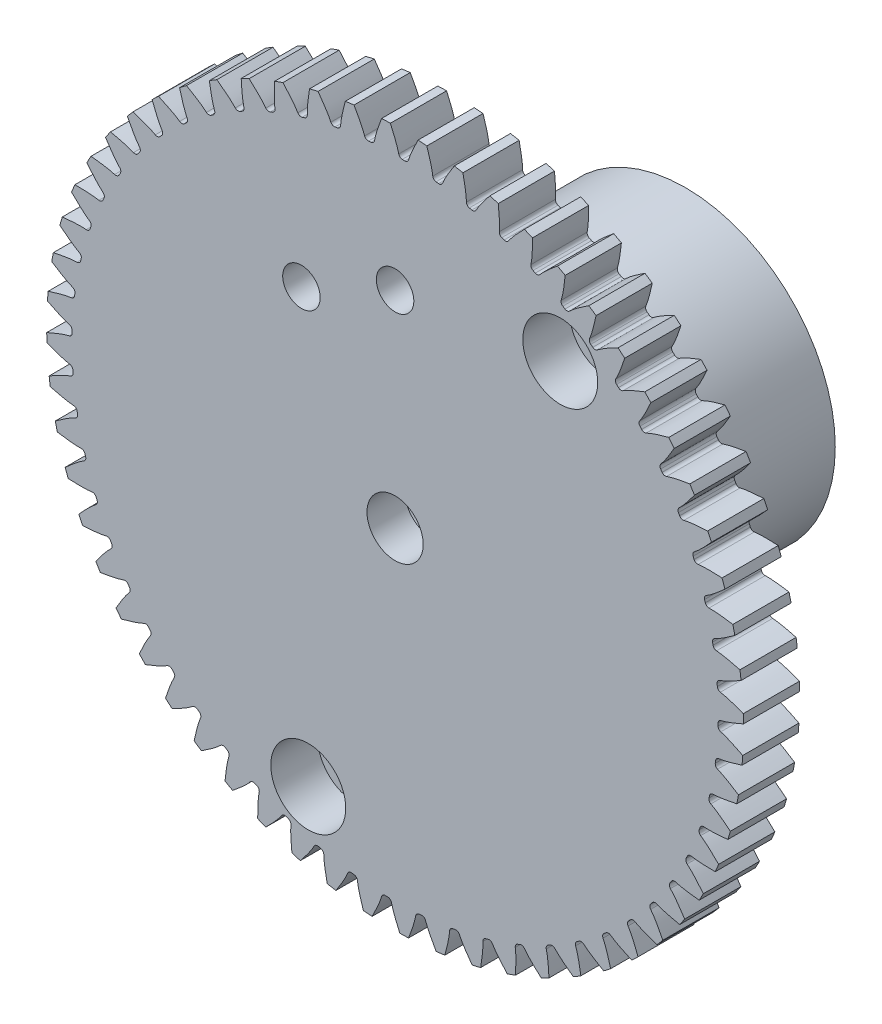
SolidWorks part; units mm, degrees
ref_plane "Face" through (0, 0, 0) normal (0, 0, 1) x (1, 0, 0)
ref_plane "Dessus" through (0, 0, 0) normal (0, 1, 0) x (1, 0, 0)
ref_plane "Droite" through (0, 0, 0) normal (1, 0, 0) x (0, 0, -1)
sketch "Esquisse1" plane through (0, 0, 0) normal (0, 0, 1) x (1, 0, 0)
  arc A480 (17.0932, -2.3205) -> (17.2163, -2.5327) centre (17.2913, -2.3474) ccw
  arc A481 (17.0932, -2.3205) -> (17.111, -2.1854) centre (0, 0) ccw
  arc A482 (17.2849, -2.0123) -> (17.111, -2.1854) centre (17.3093, -2.2107) ccw
  arc A483 (18.5227, -1.6943) -> (18.5595, -1.2271) centre (0, 0) ccw
  arc A484 (17.2421, -0.5211) -> (17.3867, -0.7192) centre (17.4419, -0.5271) ccw
  arc A485 (17.2421, -0.5211) -> (17.2457, -0.3848) centre (0, 0) ccw
  arc A486 (17.4005, -0.1945) -> (17.2457, -0.3848) centre (17.4456, -0.3893) ccw
  arc A487 (18.5983, 0.2511) -> (18.5861, 0.7196) centre (0, 0) ccw
  arc A488 (17.2021, 1.2841) -> (17.3667, 1.1021) centre (17.4015, 1.299) ccw
  arc A489 (17.2021, 1.2841) -> (17.1915, 1.42) centre (0, 0) ccw
  arc A490 (17.3255, 1.6254) -> (17.1915, 1.42) centre (17.3907, 1.4364) ccw
  arc A491 (18.4702, 2.1938) -> (18.409, 2.6585) centre (0, 0) ccw
  arc A492 (16.9737, 3.0752) -> (17.1563, 2.9114) centre (17.1704, 3.1108) ccw
  arc A493 (16.9737, 3.0752) -> (16.9489, 3.2092) centre (0, 0) ccw
  arc A494 (17.0607, 3.4275) -> (16.9489, 3.2092) centre (17.1453, 3.2464) ccw
  arc A495 (18.1397, 4.1124) -> (18.0303, 4.5682) centre (0, 0) ccw
  arc A496 (16.5593, 4.8326) -> (16.758, 4.6888) centre (16.7512, 4.8886) ccw
  arc A497 (16.5593, 4.8326) -> (16.5205, 4.9633) centre (0, 0) ccw
  arc A498 (16.609, 5.1921) -> (16.5205, 4.9633) centre (16.712, 5.0208) ccw
  arc A499 (17.6104, 5.986) -> (17.454, 6.4278) centre (0, 0) ccw
  arc A500 (15.9634, 6.537) -> (16.1761, 6.4148) centre (16.1484, 6.6127) ccw
  arc A501 (15.9634, 6.537) -> (15.9112, 6.6629) centre (0, 0) ccw
  arc A502 (15.9753, 6.8997) -> (15.9112, 6.6629) centre (16.0956, 6.7401) ccw
  arc A503 (16.8883, 7.794) -> (16.6865, 8.2171) centre (0, 0) ccw
  arc A504 (15.1927, 8.1698) -> (15.417, 8.0705) centre (15.3687, 8.2645) ccw
  arc A505 (15.1927, 8.1698) -> (15.1276, 8.2896) centre (0, 0) ccw
  arc A506 (15.1665, 8.5318) -> (15.1276, 8.2896) centre (15.3029, 8.3857) ccw
  arc A507 (15.9811, 9.5166) -> (15.7362, 9.9163) centre (0, 0) ccw
  arc A508 (14.2554, 9.7131) -> (14.4889, 9.6378) centre (14.4206, 9.8257) ccw
  arc A509 (14.2554, 9.7131) -> (14.1782, 9.8255) centre (0, 0) ccw
  arc A510 (14.1916, 10.0704) -> (14.1782, 9.8255) centre (14.3425, 9.9393) ccw
  arc A511 (14.8988, 11.1349) -> (14.6135, 11.5068) centre (0, 0) ccw
  arc A512 (13.1621, 11.15) -> (13.4021, 11.0995) centre (13.3146, 11.2792) ccw
  arc A513 (13.1621, 11.15) -> (13.0735, 11.2537) centre (0, 0) ccw
  arc A514 (13.0612, 11.4987) -> (13.0735, 11.2537) centre (13.225, 11.3841) ccw
  arc A515 (13.6532, 12.6313) -> (13.3306, 12.9713) centre (0, 0) ccw
  arc A516 (11.9245, 12.4647) -> (12.1685, 12.4396) centre (12.0626, 12.6092) ccw
  arc A517 (11.9245, 12.4647) -> (11.8256, 12.5586) centre (0, 0) ccw
  arc A518 (11.7877, 12.801) -> (11.8256, 12.5586) centre (11.9626, 12.7041) ccw
  arc A519 (12.2581, 13.9892) -> (11.9017, 14.2937) centre (0, 0) ccw
  arc A520 (10.5562, 13.6429) -> (10.8015, 13.6434) centre (10.6785, 13.801) ccw
  arc A521 (10.5562, 13.6429) -> (10.4481, 13.7259) centre (0, 0) ccw
  arc A522 (10.3851, 13.963) -> (10.4481, 13.7259) centre (10.5692, 13.885) ccw
  arc A523 (10.7287, 15.1939) -> (10.3424, 15.4594) centre (0, 0) ccw
  arc A524 (9.0723, 14.6716) -> (9.3162, 14.6977) centre (9.1775, 14.8416) ccw
  arc A525 (9.0723, 14.6716) -> (8.9561, 14.7428) centre (0, 0) ccw
  arc A526 (8.8687, 14.972) -> (8.9561, 14.7428) centre (9.0599, 14.9137) ccw
  arc A527 (9.0817, 16.2322) -> (8.6698, 16.4558) centre (0, 0) ccw
  arc A528 (7.489, 15.5395) -> (7.7289, 15.591) centre (7.5758, 15.7196) ccw
  arc A529 (7.489, 15.5395) -> (7.366, 15.5982) centre (0, 0) ccw
  arc A530 (7.2551, 15.817) -> (7.366, 15.5982) centre (7.4513, 15.779) ccw
  arc A531 (7.3352, 17.0925) -> (6.9022, 17.2719) centre (0, 0) ccw
  arc A532 (5.8237, 16.2372) -> (6.0568, 16.3135) centre (5.8912, 16.4254) ccw
  arc A533 (5.8237, 16.2372) -> (5.6952, 16.2827) centre (0, 0) ccw
  arc A534 (5.562, 16.4888) -> (5.6952, 16.2827) centre (5.7612, 16.4714) ccw
  arc A535 (5.5084, 17.7656) -> (5.059, 17.8988) centre (0, 0) ccw
  arc A536 (4.0945, 16.757) -> (4.3184, 16.8572) centre (4.142, 16.9512) ccw
  arc A537 (4.0945, 16.757) -> (3.962, 16.7888) centre (0, 0) ccw
  arc A538 (3.808, 16.9798) -> (3.962, 16.7888) centre (4.0079, 16.9834) ccw
  arc A539 (3.6212, 18.2441) -> (3.1603, 18.3295) centre (0, 0) ccw
  arc A540 (2.3205, 17.0932) -> (2.5327, 17.2163) centre (2.3474, 17.2913) ccw
  arc A541 (2.3205, 17.0932) -> (2.1854, 17.111) centre (0, 0) ccw
  arc A542 (2.0123, 17.2849) -> (2.1854, 17.111) centre (2.2107, 17.3093) ccw
  arc A543 (1.6943, 18.5227) -> (1.2271, 18.5595) centre (0, 0) ccw
  arc A544 (0.5211, 17.2421) -> (0.7192, 17.3867) centre (0.5271, 17.4419) ccw
  arc A545 (0.5211, 17.2421) -> (0.3848, 17.2457) centre (0, 0) ccw
  arc A546 (0.1945, 17.4005) -> (0.3848, 17.2457) centre (0.3893, 17.4456) ccw
  arc A547 (-0.2511, 18.5983) -> (-0.7196, 18.5861) centre (0, 0) ccw
  arc A548 (-1.2841, 17.2021) -> (-1.1021, 17.3667) centre (-1.299, 17.4015) ccw
  arc A549 (-1.2841, 17.2021) -> (-1.42, 17.1915) centre (0, 0) ccw
  arc A550 (-1.6254, 17.3255) -> (-1.42, 17.1915) centre (-1.4364, 17.3907) ccw
  arc A551 (-2.1938, 18.4702) -> (-2.6585, 18.409) centre (0, 0) ccw
  arc A552 (-3.0752, 16.9737) -> (-2.9114, 17.1563) centre (-3.1108, 17.1704) ccw
  arc A553 (-3.0752, 16.9737) -> (-3.2092, 16.9489) centre (0, 0) ccw
  arc A554 (-3.4275, 17.0607) -> (-3.2092, 16.9489) centre (-3.2464, 17.1453) ccw
  arc A555 (-4.1124, 18.1397) -> (-4.5682, 18.0303) centre (0, 0) ccw
  arc A556 (-4.8326, 16.5593) -> (-4.6888, 16.758) centre (-4.8886, 16.7512) ccw
  arc A557 (-4.8326, 16.5593) -> (-4.9633, 16.5205) centre (0, 0) ccw
  arc A558 (-5.1921, 16.609) -> (-4.9633, 16.5205) centre (-5.0208, 16.712) ccw
  arc A559 (-5.986, 17.6104) -> (-6.4278, 17.454) centre (0, 0) ccw
  arc A560 (-6.537, 15.9634) -> (-6.4148, 16.1761) centre (-6.6127, 16.1484) ccw
  arc A561 (-6.537, 15.9634) -> (-6.6629, 15.9112) centre (0, 0) ccw
  arc A562 (-6.8997, 15.9753) -> (-6.6629, 15.9112) centre (-6.7401, 16.0956) ccw
  arc A563 (-7.794, 16.8883) -> (-8.2171, 16.6865) centre (0, 0) ccw
  arc A564 (-8.1698, 15.1927) -> (-8.0705, 15.417) centre (-8.2645, 15.3687) ccw
  arc A565 (-8.1698, 15.1927) -> (-8.2896, 15.1276) centre (0, 0) ccw
  arc A566 (-8.5318, 15.1665) -> (-8.2896, 15.1276) centre (-8.3857, 15.3029) ccw
  arc A567 (-9.5166, 15.9811) -> (-9.9163, 15.7362) centre (0, 0) ccw
  arc A568 (-9.7131, 14.2554) -> (-9.6378, 14.4889) centre (-9.8257, 14.4206) ccw
  arc A569 (-9.7131, 14.2554) -> (-9.8255, 14.1782) centre (0, 0) ccw
  arc A570 (-10.0704, 14.1916) -> (-9.8255, 14.1782) centre (-9.9393, 14.3425) ccw
  arc A571 (-11.1349, 14.8988) -> (-11.5068, 14.6135) centre (0, 0) ccw
  arc A572 (-11.15, 13.1621) -> (-11.0995, 13.4021) centre (-11.2792, 13.3146) ccw
  arc A573 (-11.15, 13.1621) -> (-11.2537, 13.0735) centre (0, 0) ccw
  arc A574 (-11.4987, 13.0612) -> (-11.2537, 13.0735) centre (-11.3841, 13.225) ccw
  arc A575 (-12.6313, 13.6532) -> (-12.9713, 13.3306) centre (0, 0) ccw
  arc A576 (-12.4647, 11.9245) -> (-12.4396, 12.1685) centre (-12.6092, 12.0626) ccw
  arc A577 (-12.4647, 11.9245) -> (-12.5586, 11.8256) centre (0, 0) ccw
  arc A578 (-12.801, 11.7877) -> (-12.5586, 11.8256) centre (-12.7041, 11.9626) ccw
  arc A579 (-13.9892, 12.2581) -> (-14.2937, 11.9017) centre (0, 0) ccw
  arc A580 (-13.6429, 10.5562) -> (-13.6434, 10.8015) centre (-13.801, 10.6785) ccw
  arc A581 (-13.6429, 10.5562) -> (-13.7259, 10.4481) centre (0, 0) ccw
  arc A582 (-13.963, 10.3851) -> (-13.7259, 10.4481) centre (-13.885, 10.5692) ccw
  arc A583 (-15.1939, 10.7287) -> (-15.4594, 10.3424) centre (0, 0) ccw
  arc A584 (-14.6716, 9.0723) -> (-14.6977, 9.3162) centre (-14.8416, 9.1775) ccw
  arc A585 (-14.6716, 9.0723) -> (-14.7428, 8.9561) centre (0, 0) ccw
  arc A586 (-14.972, 8.8687) -> (-14.7428, 8.9561) centre (-14.9137, 9.0599) ccw
  arc A587 (-16.2322, 9.0817) -> (-16.4558, 8.6698) centre (0, 0) ccw
  arc A588 (-15.5395, 7.489) -> (-15.591, 7.7289) centre (-15.7196, 7.5758) ccw
  arc A589 (-15.5395, 7.489) -> (-15.5982, 7.366) centre (0, 0) ccw
  arc A590 (-15.817, 7.2551) -> (-15.5982, 7.366) centre (-15.779, 7.4513) ccw
  arc A591 (-17.0925, 7.3352) -> (-17.2719, 6.9022) centre (0, 0) ccw
  arc A592 (-16.2372, 5.8237) -> (-16.3135, 6.0568) centre (-16.4254, 5.8912) ccw
  arc A593 (-16.2372, 5.8237) -> (-16.2827, 5.6952) centre (0, 0) ccw
  arc A594 (-16.4888, 5.562) -> (-16.2827, 5.6952) centre (-16.4714, 5.7612) ccw
  arc A595 (-17.7656, 5.5084) -> (-17.8988, 5.059) centre (0, 0) ccw
  arc A596 (-16.757, 4.0945) -> (-16.8572, 4.3184) centre (-16.9512, 4.142) ccw
  arc A597 (-16.757, 4.0945) -> (-16.7888, 3.962) centre (0, 0) ccw
  arc A598 (-16.9798, 3.808) -> (-16.7888, 3.962) centre (-16.9834, 4.0079) ccw
  arc A599 (-18.2441, 3.6212) -> (-18.3295, 3.1603) centre (0, 0) ccw
  arc A600 (-17.0932, 2.3205) -> (-17.2163, 2.5327) centre (-17.2913, 2.3474) ccw
  arc A601 (-17.0932, 2.3205) -> (-17.111, 2.1854) centre (0, 0) ccw
  arc A602 (-17.2849, 2.0123) -> (-17.111, 2.1854) centre (-17.3093, 2.2107) ccw
  arc A603 (-18.5227, 1.6943) -> (-18.5595, 1.2271) centre (0, 0) ccw
  arc A604 (-17.2421, 0.5211) -> (-17.3867, 0.7192) centre (-17.4419, 0.5271) ccw
  arc A605 (-17.2421, 0.5211) -> (-17.2457, 0.3848) centre (0, 0) ccw
  arc A606 (-17.4005, 0.1945) -> (-17.2457, 0.3848) centre (-17.4456, 0.3893) ccw
  arc A607 (-18.5983, -0.2511) -> (-18.5861, -0.7196) centre (0, 0) ccw
  arc A608 (-17.2021, -1.2841) -> (-17.3667, -1.1021) centre (-17.4015, -1.299) ccw
  arc A609 (-17.2021, -1.2841) -> (-17.1915, -1.42) centre (0, 0) ccw
  arc A610 (-17.3255, -1.6254) -> (-17.1915, -1.42) centre (-17.3907, -1.4364) ccw
  arc A611 (-18.4702, -2.1938) -> (-18.409, -2.6585) centre (0, 0) ccw
  arc A612 (-16.9737, -3.0752) -> (-17.1563, -2.9114) centre (-17.1704, -3.1108) ccw
  arc A613 (-16.9737, -3.0752) -> (-16.9489, -3.2092) centre (0, 0) ccw
  arc A614 (-17.0607, -3.4275) -> (-16.9489, -3.2092) centre (-17.1453, -3.2464) ccw
  arc A615 (-18.1397, -4.1124) -> (-18.0303, -4.5682) centre (0, 0) ccw
  arc A616 (-16.5593, -4.8326) -> (-16.758, -4.6888) centre (-16.7512, -4.8886) ccw
  arc A617 (-16.5593, -4.8326) -> (-16.5205, -4.9633) centre (0, 0) ccw
  arc A618 (-16.609, -5.1921) -> (-16.5205, -4.9633) centre (-16.712, -5.0208) ccw
  arc A619 (-17.6104, -5.986) -> (-17.454, -6.4278) centre (0, 0) ccw
  arc A620 (-15.9634, -6.537) -> (-16.1761, -6.4148) centre (-16.1484, -6.6127) ccw
  arc A621 (-15.9634, -6.537) -> (-15.9112, -6.6629) centre (0, 0) ccw
  arc A622 (-15.9753, -6.8997) -> (-15.9112, -6.6629) centre (-16.0956, -6.7401) ccw
  arc A623 (-16.8883, -7.794) -> (-16.6865, -8.2171) centre (0, 0) ccw
  arc A624 (-15.1927, -8.1698) -> (-15.417, -8.0705) centre (-15.3687, -8.2645) ccw
  arc A625 (-15.1927, -8.1698) -> (-15.1276, -8.2896) centre (0, 0) ccw
  arc A626 (-15.1665, -8.5318) -> (-15.1276, -8.2896) centre (-15.3029, -8.3857) ccw
  arc A627 (-15.9811, -9.5166) -> (-15.7362, -9.9163) centre (0, 0) ccw
  arc A628 (-14.2554, -9.7131) -> (-14.4889, -9.6378) centre (-14.4206, -9.8257) ccw
  arc A629 (-14.2554, -9.7131) -> (-14.1782, -9.8255) centre (0, 0) ccw
  arc A630 (-14.1916, -10.0704) -> (-14.1782, -9.8255) centre (-14.3425, -9.9393) ccw
  arc A631 (-14.8988, -11.1349) -> (-14.6135, -11.5068) centre (0, 0) ccw
  arc A632 (-13.1621, -11.15) -> (-13.4021, -11.0995) centre (-13.3146, -11.2792) ccw
  arc A633 (-13.1621, -11.15) -> (-13.0735, -11.2537) centre (0, 0) ccw
  arc A634 (-13.0612, -11.4987) -> (-13.0735, -11.2537) centre (-13.225, -11.3841) ccw
  arc A635 (-13.6532, -12.6313) -> (-13.3306, -12.9713) centre (0, 0) ccw
  arc A636 (-11.9245, -12.4647) -> (-12.1685, -12.4396) centre (-12.0626, -12.6092) ccw
  arc A637 (-11.9245, -12.4647) -> (-11.8256, -12.5586) centre (0, 0) ccw
  arc A638 (-11.7877, -12.801) -> (-11.8256, -12.5586) centre (-11.9626, -12.7041) ccw
  arc A639 (-12.2581, -13.9892) -> (-11.9017, -14.2937) centre (0, 0) ccw
  arc A640 (-10.5562, -13.6429) -> (-10.8015, -13.6434) centre (-10.6785, -13.801) ccw
  arc A641 (-10.5562, -13.6429) -> (-10.4481, -13.7259) centre (0, 0) ccw
  arc A642 (-10.3851, -13.963) -> (-10.4481, -13.7259) centre (-10.5692, -13.885) ccw
  arc A643 (-10.7287, -15.1939) -> (-10.3424, -15.4594) centre (0, 0) ccw
  arc A644 (-9.0723, -14.6716) -> (-9.3162, -14.6977) centre (-9.1775, -14.8416) ccw
  arc A645 (-9.0723, -14.6716) -> (-8.9561, -14.7428) centre (0, 0) ccw
  arc A646 (-8.8687, -14.972) -> (-8.9561, -14.7428) centre (-9.0599, -14.9137) ccw
  arc A647 (-9.0817, -16.2322) -> (-8.6698, -16.4558) centre (0, 0) ccw
  arc A648 (-7.489, -15.5395) -> (-7.7289, -15.591) centre (-7.5758, -15.7196) ccw
  arc A649 (-7.489, -15.5395) -> (-7.366, -15.5982) centre (0, 0) ccw
  arc A650 (-7.2551, -15.817) -> (-7.366, -15.5982) centre (-7.4513, -15.779) ccw
  arc A651 (-7.3352, -17.0925) -> (-6.9022, -17.2719) centre (0, 0) ccw
  arc A652 (-5.8237, -16.2372) -> (-6.0568, -16.3135) centre (-5.8912, -16.4254) ccw
  arc A653 (-5.8237, -16.2372) -> (-5.6952, -16.2827) centre (0, 0) ccw
  arc A654 (-5.562, -16.4888) -> (-5.6952, -16.2827) centre (-5.7612, -16.4714) ccw
  arc A655 (-5.5084, -17.7656) -> (-5.059, -17.8988) centre (0, 0) ccw
  arc A656 (-4.0945, -16.757) -> (-4.3184, -16.8572) centre (-4.142, -16.9512) ccw
  arc A657 (-4.0945, -16.757) -> (-3.962, -16.7888) centre (0, 0) ccw
  arc A658 (-3.808, -16.9798) -> (-3.962, -16.7888) centre (-4.0079, -16.9834) ccw
  arc A659 (-3.6212, -18.2441) -> (-3.1603, -18.3295) centre (0, 0) ccw
  arc A660 (-2.3205, -17.0932) -> (-2.5327, -17.2163) centre (-2.3474, -17.2913) ccw
  arc A661 (-2.3205, -17.0932) -> (-2.1854, -17.111) centre (0, 0) ccw
  arc A662 (-2.0123, -17.2849) -> (-2.1854, -17.111) centre (-2.2107, -17.3093) ccw
  arc A663 (-1.6943, -18.5227) -> (-1.2271, -18.5595) centre (0, 0) ccw
  arc A664 (-0.5211, -17.2421) -> (-0.7192, -17.3867) centre (-0.5271, -17.4419) ccw
  arc A665 (-0.5211, -17.2421) -> (-0.3848, -17.2457) centre (0, 0) ccw
  arc A666 (-0.1945, -17.4005) -> (-0.3848, -17.2457) centre (-0.3893, -17.4456) ccw
  arc A667 (0.2511, -18.5983) -> (0.7196, -18.5861) centre (0, 0) ccw
  arc A668 (1.2841, -17.2021) -> (1.1021, -17.3667) centre (1.299, -17.4015) ccw
  arc A669 (1.2841, -17.2021) -> (1.42, -17.1915) centre (0, 0) ccw
  arc A670 (1.6254, -17.3255) -> (1.42, -17.1915) centre (1.4364, -17.3907) ccw
  arc A671 (2.1938, -18.4702) -> (2.6585, -18.409) centre (0, 0) ccw
  arc A672 (3.0752, -16.9737) -> (2.9114, -17.1563) centre (3.1108, -17.1704) ccw
  arc A673 (3.0752, -16.9737) -> (3.2092, -16.9489) centre (0, 0) ccw
  arc A674 (3.4275, -17.0607) -> (3.2092, -16.9489) centre (3.2464, -17.1453) ccw
  arc A675 (4.1124, -18.1397) -> (4.5682, -18.0303) centre (0, 0) ccw
  arc A676 (4.8326, -16.5593) -> (4.6888, -16.758) centre (4.8886, -16.7512) ccw
  arc A677 (4.8326, -16.5593) -> (4.9633, -16.5205) centre (0, 0) ccw
  arc A678 (5.1921, -16.609) -> (4.9633, -16.5205) centre (5.0208, -16.712) ccw
  arc A679 (5.986, -17.6104) -> (6.4278, -17.454) centre (0, 0) ccw
  arc A680 (6.537, -15.9634) -> (6.4148, -16.1761) centre (6.6127, -16.1484) ccw
  arc A681 (6.537, -15.9634) -> (6.6629, -15.9112) centre (0, 0) ccw
  arc A682 (6.8997, -15.9753) -> (6.6629, -15.9112) centre (6.7401, -16.0956) ccw
  arc A683 (7.794, -16.8883) -> (8.2171, -16.6865) centre (0, 0) ccw
  arc A684 (8.1698, -15.1927) -> (8.0705, -15.417) centre (8.2645, -15.3687) ccw
  arc A685 (8.1698, -15.1927) -> (8.2896, -15.1276) centre (0, 0) ccw
  arc A686 (8.5318, -15.1665) -> (8.2896, -15.1276) centre (8.3857, -15.3029) ccw
  arc A687 (9.5166, -15.9811) -> (9.9163, -15.7362) centre (0, 0) ccw
  arc A688 (9.7131, -14.2554) -> (9.6378, -14.4889) centre (9.8257, -14.4206) ccw
  arc A689 (9.7131, -14.2554) -> (9.8255, -14.1782) centre (0, 0) ccw
  arc A690 (10.0704, -14.1916) -> (9.8255, -14.1782) centre (9.9393, -14.3425) ccw
  arc A691 (11.1349, -14.8988) -> (11.5068, -14.6135) centre (0, 0) ccw
  arc A692 (11.15, -13.1621) -> (11.0995, -13.4021) centre (11.2792, -13.3146) ccw
  arc A693 (11.15, -13.1621) -> (11.2537, -13.0735) centre (0, 0) ccw
  arc A694 (11.4987, -13.0612) -> (11.2537, -13.0735) centre (11.3841, -13.225) ccw
  arc A695 (12.6313, -13.6532) -> (12.9713, -13.3306) centre (0, 0) ccw
  arc A696 (12.4647, -11.9245) -> (12.4396, -12.1685) centre (12.6092, -12.0626) ccw
  arc A697 (12.4647, -11.9245) -> (12.5586, -11.8256) centre (0, 0) ccw
  arc A698 (12.801, -11.7877) -> (12.5586, -11.8256) centre (12.7041, -11.9626) ccw
  arc A699 (13.9892, -12.2581) -> (14.2937, -11.9017) centre (0, 0) ccw
  arc A700 (13.6429, -10.5562) -> (13.6434, -10.8015) centre (13.801, -10.6785) ccw
  arc A701 (13.6429, -10.5562) -> (13.7259, -10.4481) centre (0, 0) ccw
  arc A702 (13.963, -10.3851) -> (13.7259, -10.4481) centre (13.885, -10.5692) ccw
  arc A703 (15.1939, -10.7287) -> (15.4594, -10.3424) centre (0, 0) ccw
  arc A704 (14.6716, -9.0723) -> (14.6977, -9.3162) centre (14.8416, -9.1775) ccw
  arc A705 (14.6716, -9.0723) -> (14.7428, -8.9561) centre (0, 0) ccw
  arc A706 (14.972, -8.8687) -> (14.7428, -8.9561) centre (14.9137, -9.0599) ccw
  arc A707 (16.2322, -9.0817) -> (16.4558, -8.6698) centre (0, 0) ccw
  arc A708 (15.5395, -7.489) -> (15.591, -7.7289) centre (15.7196, -7.5758) ccw
  arc A709 (15.5395, -7.489) -> (15.5982, -7.366) centre (0, 0) ccw
  arc A710 (15.817, -7.2551) -> (15.5982, -7.366) centre (15.779, -7.4513) ccw
  arc A711 (17.0925, -7.3352) -> (17.2719, -6.9022) centre (0, 0) ccw
  arc A712 (16.2372, -5.8237) -> (16.3135, -6.0568) centre (16.4254, -5.8912) ccw
  arc A713 (16.2372, -5.8237) -> (16.2827, -5.6952) centre (0, 0) ccw
  arc A714 (16.4888, -5.562) -> (16.2827, -5.6952) centre (16.4714, -5.7612) ccw
  arc A715 (17.7656, -5.5084) -> (17.8988, -5.059) centre (0, 0) ccw
  arc A716 (16.757, -4.0945) -> (16.8572, -4.3184) centre (16.9512, -4.142) ccw
  arc A717 (16.757, -4.0945) -> (16.7888, -3.962) centre (0, 0) ccw
  arc A718 (16.9798, -3.808) -> (16.7888, -3.962) centre (16.9834, -4.0079) ccw
  arc A719 (18.2441, -3.6212) -> (18.3295, -3.1603) centre (0, 0) ccw
extrude "Base-Extrusion" add sketch "Esquisse1" along normal blind 3
sketch "Esquisse3" plane through (2.8319, -1.7433, 3) normal (0, 0, 1) x (1, 0, 0)
  line L0 (-2.8319, 1.7433) -> (-2.8319, 12.7433) construction
  line L1 (-2.8319, 1.7433) -> (-7.8319, 10.4035) construction
  circle A1 centre (-2.8319, 12.7433) radius 1
  circle A3 centre (-7.8319, 10.4035) radius 1
  dimension "D2" = 2
  dimension "D3" = 2
  dimension "D1" = 30
  dimension "D4" = 11
  dimension "D5" = 10
extrude "Enlèv. mat.-Extru.1" cut sketch "Esquisse3" against normal through all
sketch "Esquisse4" plane through (0, 0, 0) normal (0, 0, -1) x (-1, 0, 0)
  circle A0 centre (0, 0) radius 3.25
  dimension "D1" = 6.5
extrude "Enlèv. mat.-Extru.2" cut sketch "Esquisse4" against normal blind 1
sketch "Esquisse5" plane through (0, 0, 1) normal (0, 0, -1) x (-1, 0, 0)
  circle A0 centre (0, 0) radius 1.5
  dimension "D1" = 3
extrude "Enlèv. mat.-Extru.3" cut sketch "Esquisse5" against normal through all
sketch "Esquisse6" plane through (0, 0, 0) normal (0, 0, -1) x (-1, 0, 0)
  circle A0 centre (0, 0) radius 8
  circle A1 centre (0, 0) radius 5
  dimension "D1" = 16
  dimension "D2" = 10
extrude "Boss.-Extru.1" add sketch "Esquisse6" along normal blind 14
chamfer "Chanfrein1" distance 1.5 distance2 2.6
sketch "Esquisse7" plane through (0, 0, 3) normal (0, 0, 1) x (1, 0, 0)
  line L0 (0, 0) -> (-5, 8.6603) construction
  line L1 (0, 0) -> (11.961, 16.4629) construction
  line L2 (0, 0) -> (-6.3239, -19.463) construction
  circle A0 centre (0, 0) radius 15 construction
  circle A1 centre (8.8168, 12.1353) radius 2
  circle A2 centre (-4.6353, -14.2658) radius 2
  dimension "D1" = 30
  dimension "D4" = 4
  dimension "D2" = 132
  dimension "D3" = 66
extrude "Enlèv. mat.-Extru.4" cut sketch "Esquisse7" against normal blind 2.5
